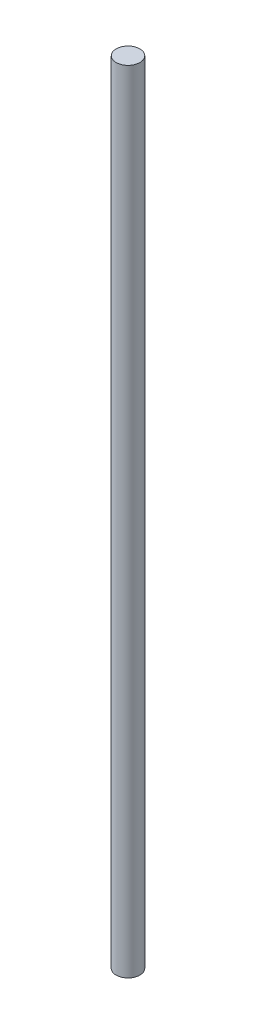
SolidWorks part; units mm, degrees
ref_plane "Front Plane" through (0, 0, 0) normal (0, 0, 1) x (1, 0, 0)
ref_plane "Top Plane" through (0, 0, 0) normal (0, 1, 0) x (1, 0, 0)
ref_plane "Right Plane" through (0, 0, 0) normal (1, 0, 0) x (0, 0, -1)
sketch "Sketch1" plane through (0, 0, 0) normal (0, 1, 0) x (1, 0, 0)
  circle A0 centre (0, 0) radius 1.5
  dimension "D1" = 3
extrude "Boss-Extrude1" add sketch "Sketch1" along normal blind 100
